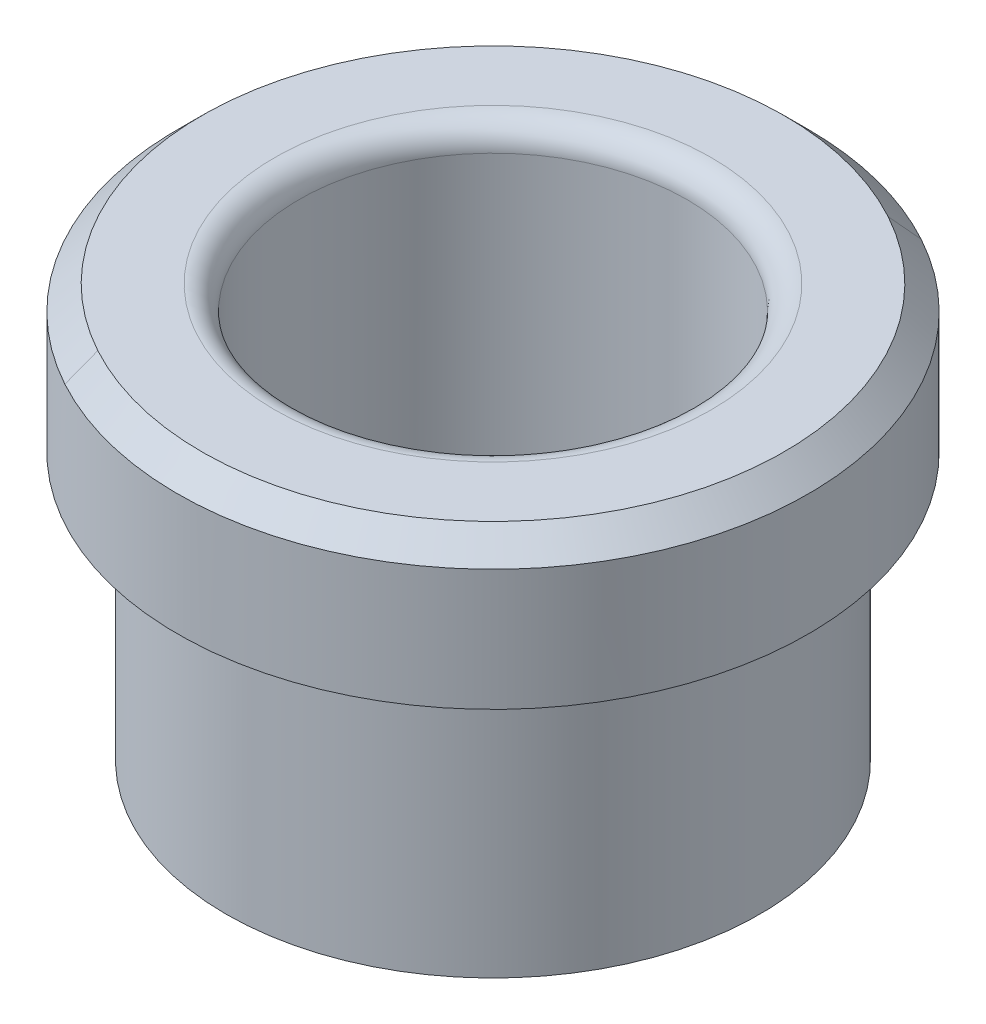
SolidWorks part; units mm, degrees
ref_plane "Plan de face" through (0, 0, 0) normal (0, 0, 1) x (1, 0, 0)
ref_plane "Plan de dessus" through (0, 0, 0) normal (0, 1, 0) x (1, 0, 0)
ref_plane "Plan de droite" through (0, 0, 0) normal (1, 0, 0) x (0, 0, -1)
imported_body "Importée1"
sketch "Esquisse1" plane through (0, -20, 0) normal (0, -1, 0) x (1, 0, 0)
  circle A0 centre (0, 0) radius 11
extrude "Enlèv. mat.-Extru.1" cut sketch "Esquisse1" against normal blind 3
fillet "Congé1" radius 1 1 edges at (0, -17, -8)
